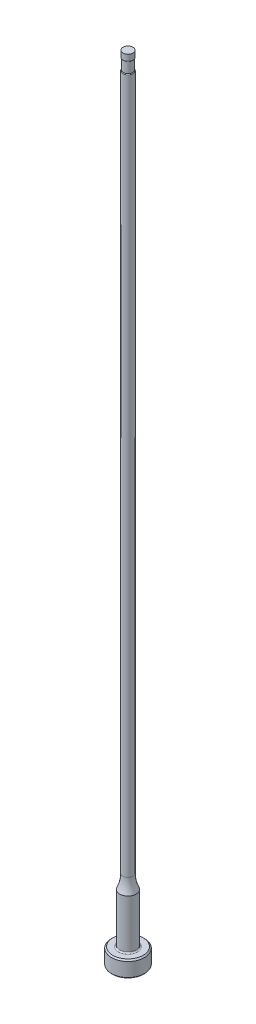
SolidWorks part; units mm, degrees
ref_plane "Front Plane" through (0, 0, 0) normal (0, 0, 1) x (1, 0, 0)
ref_plane "Top Plane" through (0, 0, 0) normal (0, 1, 0) x (1, 0, 0)
ref_plane "Right Plane" through (0, 0, 0) normal (1, 0, 0) x (0, 0, -1)
other "Configuration Table"
sketch "Sketch1" plane through (0, 0, 0) normal (0, 0, 1) x (1, 0, 0)
  line L0 (0, 259.9588) -> (0, -15.1925) construction
  line L1 (0, 0) -> (-3.175, 0)
  line L2 (-3.175, 0) -> (-3.175, 3.175)
  line L3 (-3.175, 3.175) -> (-1.5875, 3.175)
  line L4 (-0.9919, 15.3851) -> (-0.9919, 152.4)
  line L5 (-0.9919, 152.4) -> (0, 152.4)
  line L6 (0, 152.4) -> (0, 0)
  line L7 (-1.5875, 3.175) -> (-1.5875, 12.7)
  arc A1 (-1.5875, 12.7) -> (-0.9919, 15.3851) centre (-7.3419, 15.3851) ccw
  dimension "D1" = 6.35
  dimension "L" = 152.4
  dimension "D2" = 3.175
  dimension "H" = 6.35
  dimension "T" = 3.175
  dimension "D" = 1.9837
  dimension "S" = 12.7
revolve "Revolve1" add sketch "Sketch1" angle 360 about L0
chamfer "Chamfer1" distance 0.254 angle 45 2 edges at (0, 3.175, 3.175) (0, 0, 3.175)
fillet "Fillet1" radius 0.254 1 edges at (0, 3.175, 1.5875)
sketch "Sketch2" plane through (0, 0, 0) normal (0, 0, 1) x (1, 0, 0)
  line L0 (-0.9919, 152.4) -> (-0.9919, 15.3851) construction
  line L1 (-0.9919, 151.13) -> (-0.8903, 151.13)
  line L2 (-0.9919, 151.13) -> (-0.9919, 149.098)
  line L3 (-0.9919, 149.098) -> (-0.8903, 149.098)
  line L4 (-0.8903, 151.13) -> (-0.8903, 149.098)
  line L5 (0.9919, 152.4) -> (-0.9919, 152.4) construction
  line L6 (0, 153.4483) -> (0, 147.3282) construction
  dimension "D1" = 2.032
  dimension "N" = 1.27
  dimension "FD" = 0.1016
  dimension "D3" = 1.7805
revolve "Vent Relief" cut sketch "Sketch2" angle 360 about L6
sketch "Sketch3" plane through (0, 0, 0) normal (0, 0, 1) x (1, 0, 0)
  line L0 (-0.8903, 150.114) -> (-0.8903, 112.014)
  line L1 (-0.8903, 151.13) -> (-0.8903, 149.098) construction
  line L2 (-0.9919, 149.098) -> (-0.9919, 15.3851) construction
  line L3 (-0.9919, 111.2172) -> (-0.9919, 150.114)
  line L4 (-0.9919, 150.114) -> (-0.8903, 150.114)
  arc A0 (-0.8903, 112.014) -> (-0.9919, 111.2172) centre (-4.0653, 112.014) cw
  dimension "D1" = 3.175
  dimension "D2" = 38.1
extrude "D-Slot" cut sketch "Sketch3" against normal through all both and the other way through all
sketch "Sketch5" plane through (0, 0, 0) normal (0, 0, 1) x (1, 0, 0)
  line L0 (-0.9919, 151.13) -> (0.9919, 151.13) construction
  line L1 (-0.9919, 152.4) -> (-0.9728, 152.4)
  line L2 (-0.9919, 152.4) -> (-0.9919, 151.13)
  line L3 (-0.9919, 151.13) -> (-0.9728, 151.13)
  line L4 (-0.9728, 152.4) -> (-0.9728, 151.13)
  line L5 (0, 152.6877) -> (0, 150.5771) construction
  dimension "VP" = 0.019
revolve "Vent Diameter" cut sketch "Sketch5" angle 360 about L5
fillet "Fillet2" radius 0.127 2 edges at (0.9919, 149.098, 0) (0, 151.13, 0.9728)
sketch "Pocket Sketch" plane through (0, 0, 0) normal (0, 0, 1) x (1, 0, 0)
  line L0 (-3.5719, 0) -> (-3.5719, 3.2004)
  line L1 (-3.5719, 3.2004) -> (-1.9523, 3.2004)
  line L2 (-1.1903, 3.9624) -> (-1.1903, 22.225)
  line L3 (-1.1903, 22.225) -> (0, 22.225)
  line L4 (0, 22.225) -> (0, 0)
  line L5 (0, 0) -> (-3.5719, 0)
  line L6 (0, 12.6104) -> (0, -2.4989) construction
  line L7 (-3.175, 2.921) -> (-3.175, 0.254) construction
  line L8 (2.921, 3.175) -> (-2.921, 3.175) construction
  line L9 (-0.9919, 111.2172) -> (-0.9919, 15.3851) construction
  line L10 (-1.9523, 3.2004) -> (-1.1903, 3.9624)
  point P3 (-1.1903, 3.2004)
  dimension "D1" = 7.1437
  dimension "D2" = 0.3969
  dimension "D3" = 0.0254
  dimension "D4" = 0.1984
  dimension "D5" = 2.3806
  dimension "D6" = 22.225
